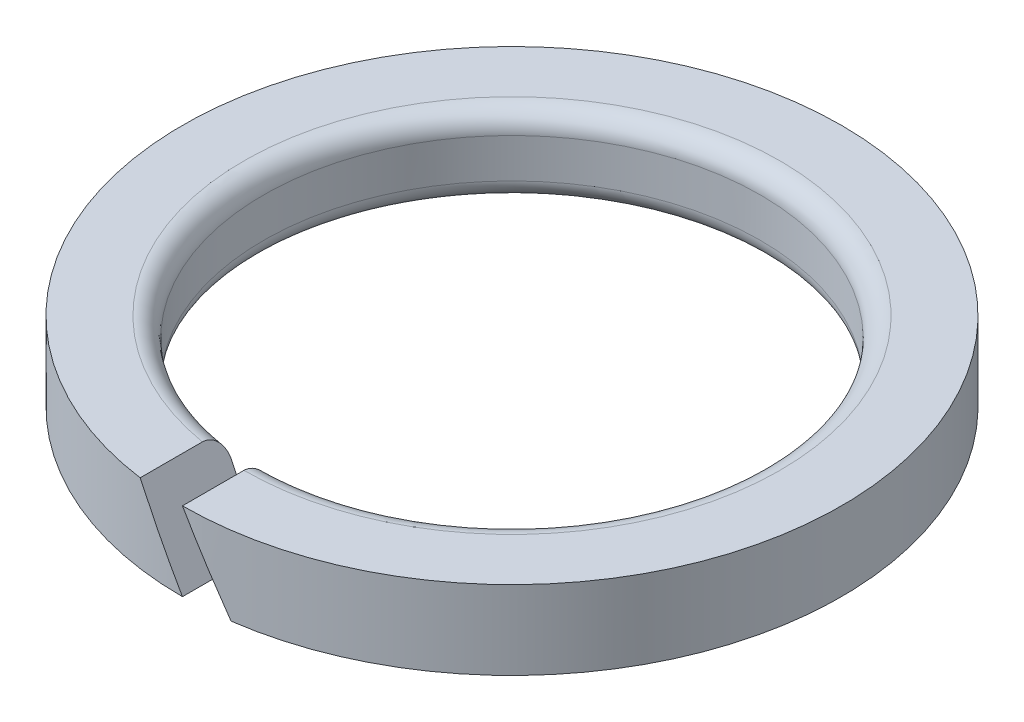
SolidWorks part; units mm, degrees
ref_plane "Front Plane" through (0, 0, 0) normal (0, 0, 1) x (1, 0, 0)
ref_plane "Top Plane" through (0, 0, 0) normal (0, 1, 0) x (1, 0, 0)
ref_plane "Right Plane" through (0, 0, 0) normal (1, 0, 0) x (0, 0, -1)
sketch "BodySke" plane through (0, 0, 0) normal (0, 1, 0) x (1, 0, 0)
  circle A0 centre (0, 0) radius 25.25
  circle A1 centre (0, 0) radius 33.5
  dimension "Inner_dia" = 50.5
  dimension "Outer_dia" = 67
extrude "BaseBody" add sketch "BodySke" along normal blind 8
sketch "SlitSke" plane through (0, 0, 0) normal (0, 0, 1) x (1, 0, 0)
  line L0 (0, 0) -> (-4.6188, 8)
  line L1 (25.25, 8) -> (-25.25, 8) construction
  line L2 (-4.6188, 8) -> (0, 8)
  line L3 (0, 8) -> (4.6188, 0)
  line L4 (-33.5, 0) -> (33.5, 0) construction
  line L5 (4.6188, 0) -> (0, 0)
  dimension "Angle" = 120
extrude "Slit" cut sketch "SlitSke" along normal through all
fillet "Fillet1" radius 2 2 edges at (-2.3192, 0, -25.1433) (2.3192, 8, -25.1433)
